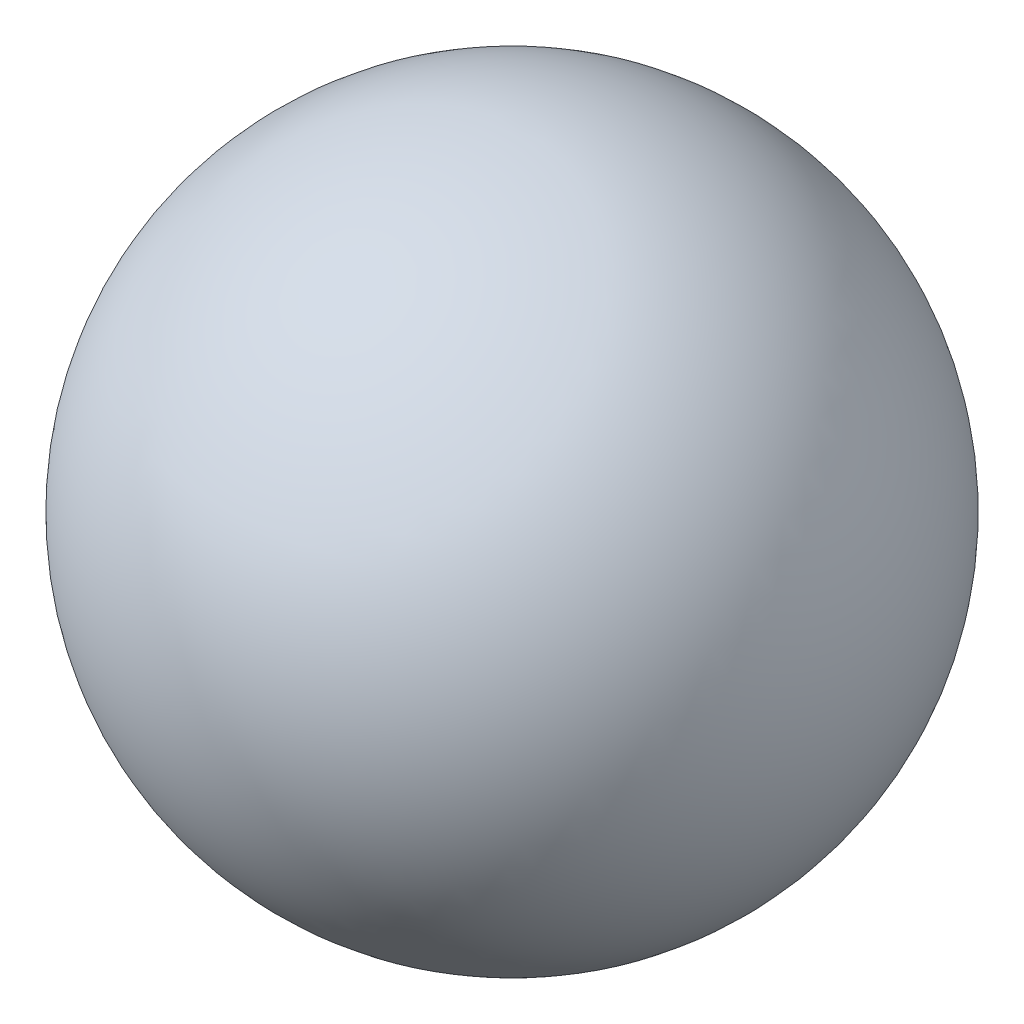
SolidWorks part; units mm, degrees
ref_plane "Plan1" through (0, 0, 0) normal (0, 0, 1) x (1, 0, 0)
ref_plane "Plan2" through (0, 0, 0) normal (0, 1, 0) x (1, 0, 0)
ref_plane "Plan3" through (0, 0, 0) normal (1, 0, 0) x (0, 0, -1)
sketch "Esquisse1" plane through (0, 0, 0) normal (0, 0, 1) x (1, 0, 0)
  line L0 (0, 27.9274) -> (0, -19.3343) construction
  line L1 (0, 2.5) -> (0, -2.5)
  arc A0 (0, -2.5) -> (0, 2.5) centre (0, 0) ccw
  dimension "D1" = 2.5
revolve "Base-Révolution" add sketch "Esquisse1" angle 360 about L0
